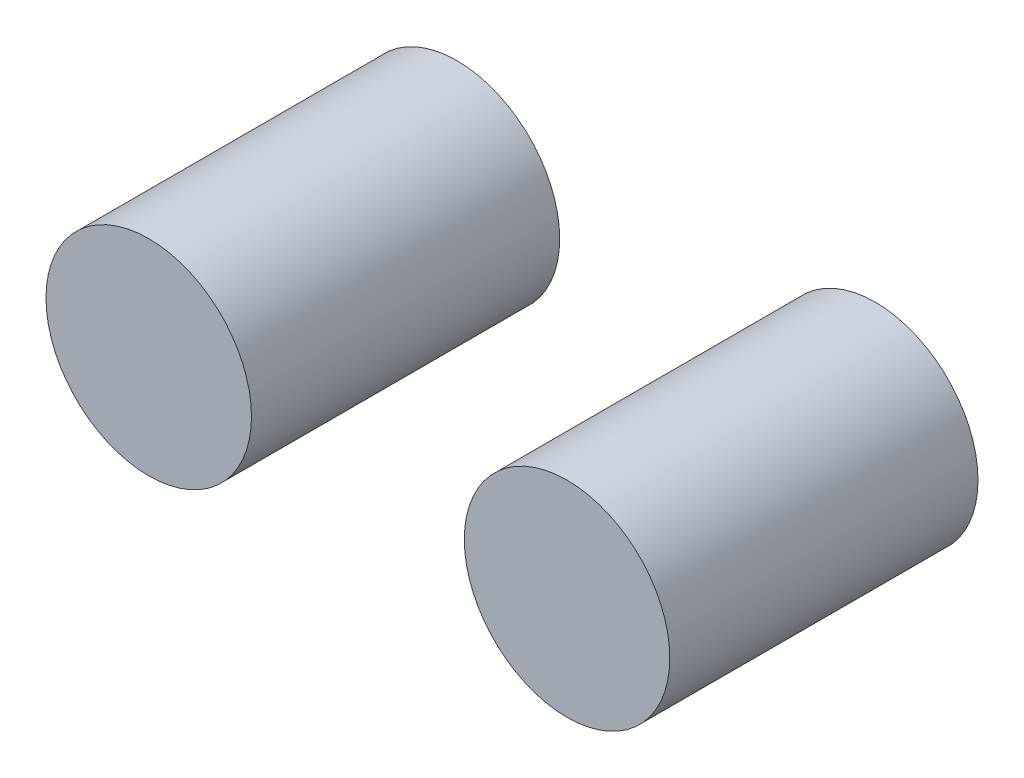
SolidWorks part; units mm, degrees
ref_plane "Plano frontal" through (0, 0, 0) normal (0, 0, 1) x (1, 0, 0)
ref_plane "Plano superior" through (0, 0, 0) normal (0, 1, 0) x (1, 0, 0)
ref_plane "Plano direito" through (0, 0, 0) normal (1, 0, 0) x (0, 0, -1)
sketch "Esboço2" plane through (0, 0, 0) normal (0, 0, 1) x (1, 0, 0)
  circle A4 centre (-6.8623, 7.6569) radius 1
  circle A5 centre (-2.7908, 7.6569) radius 1
extrude "Ressalto-extrusão2" add sketch "Esboço2" along normal blind 3
